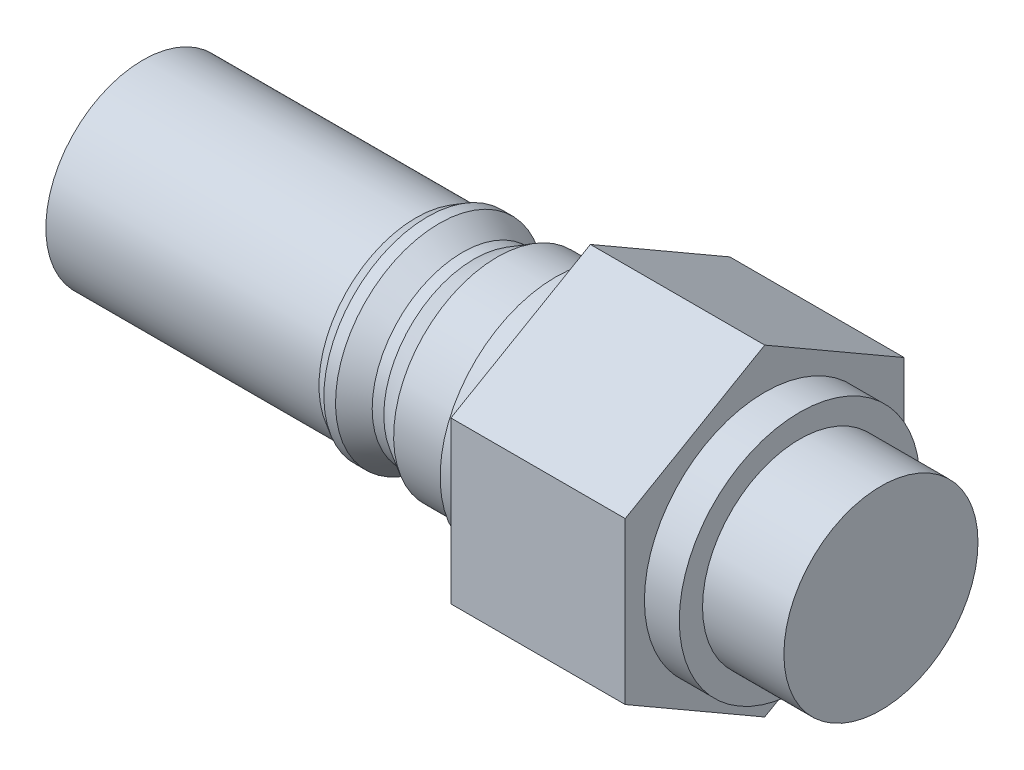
SolidWorks part; units mm, degrees
ref_plane "Alzado" through (0, 0, 0) normal (0, 0, 1) x (1, 0, 0)
ref_plane "Planta" through (0, 0, 0) normal (0, 1, 0) x (1, 0, 0)
ref_plane "Vista lateral" through (0, 0, 0) normal (1, 0, 0) x (0, 0, -1)
sketch "Croquis1" plane through (0, 0, 0) normal (0, 0, 1) x (1, 0, 0)
  line L0 (0, 0) -> (38.5, 0) construction
  line L1 (0, 0) -> (0, 8.35)
  line L2 (0, 8.35) -> (23.5, 8.35)
  line L3 (23.5, 8.35) -> (24.5, 8.9274)
  line L4 (24.5, 8.9274) -> (25.5, 8.9274)
  line L5 (25, 8.9274) -> (25, 0) construction
  line L6 (26.5, 8.35) -> (25.5, 8.9274)
  line L7 (26.5, 8.35) -> (27.5, 7.7726)
  line L8 (27.5, 7.7726) -> (28.5, 7.7726)
  line L9 (28, 7.7726) -> (28, 0) construction
  line L10 (29.5, 8.35) -> (28.5, 7.7726)
  line L11 (29.5, 8.35) -> (30.5, 8.9274)
  line L12 (30.5, 8.9274) -> (35.5, 8.9274)
  line L14 (38.5, 0) -> (0, 0)
  line L15 (35.5, 8.9274) -> (35.5, 9.9274)
  line L16 (35.5, 9.9274) -> (38.5, 9.9274)
  line L17 (38.5, 9.9274) -> (38.5, 0)
  point P18 (27.5743, 0)
  dimension "D1" = 16.7
  dimension "D2" = 23.5
  dimension "D3" = 1
  dimension "D4" = 1
  dimension "D5" = 150
  dimension "D6" = 1
  dimension "D7" = 1
  dimension "D8" = 5
  dimension "D9" = 1
  dimension "D10" = 3
revolve "Revolución1" add sketch "Croquis1" angle 360 about L14
sketch "Croquis8" plane through (38.5, 0, 0) normal (1, 0, 0) x (0, 0, -1)
  line L1 (0, 13.8564) -> (-12, 6.9282)
  line L2 (-12, 6.9282) -> (-12, -6.9282)
  line L3 (-12, -6.9282) -> (0, -13.8564)
  line L4 (0, -13.8564) -> (12, -6.9282)
  line L5 (12, -6.9282) -> (12, 6.9282)
  line L6 (12, 6.9282) -> (0, 13.8564)
  circle A0 centre (0, 0) radius 12 construction
  dimension "D1" = 24
extrude "Saliente-Extruir6" add sketch "Croquis8" along normal blind 15
sketch "Croquis10" plane through (0, 0, 0) normal (0, 0, 1) x (1, 0, 0)
  line L0 (53.5, 0) -> (63.5, 0) construction
  line L1 (53.5, 6.9282) -> (53.5, -6.9282) construction
  line L2 (63.5, 0) -> (63.5, 8.35)
  line L3 (63.5, 8.35) -> (56.5, 8.35)
  line L4 (56.5, 8.35) -> (56.5, 10.35)
  line L5 (56.5, 10.35) -> (53.5, 10.35)
  line L6 (53.5, 10.35) -> (53.5, 0)
  line L7 (53.5, 0) -> (63.5, 0)
  line L8 (53.5, 0) -> (108.8542, 0) construction
  dimension "D1" = 10
  dimension "D2" = 3
  dimension "D3" = 16.7
  dimension "D4" = 2
revolve "Revolución3" add sketch "Croquis10" angle 360 about L8
